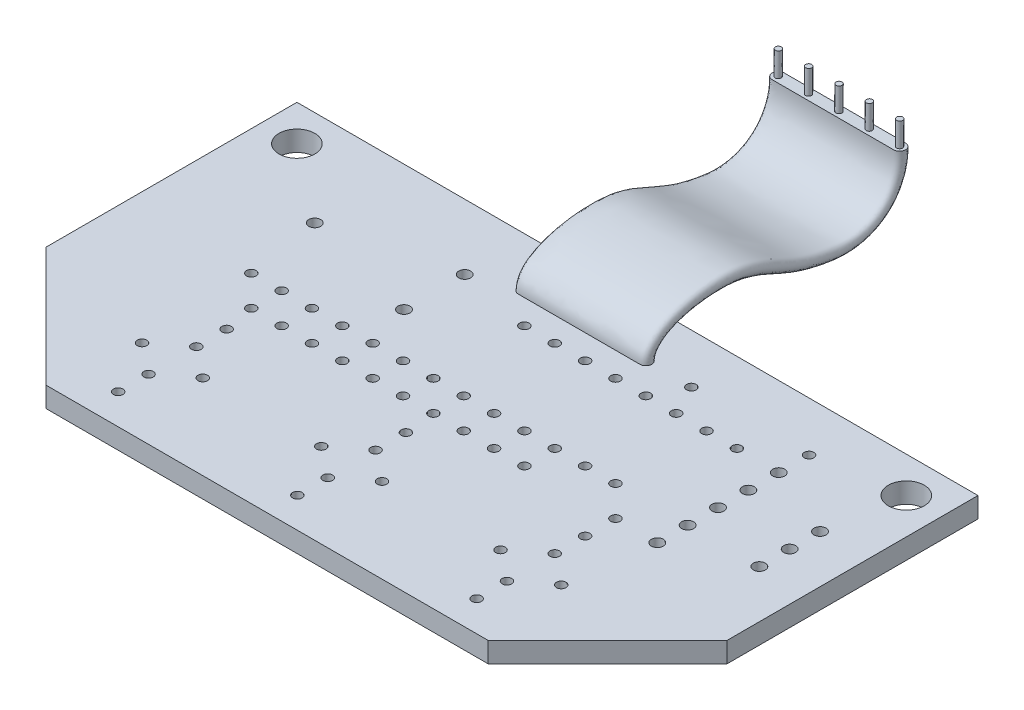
SolidWorks part; units mm, degrees
ref_plane "Plan de face" through (0, 0, 0) normal (0, 0, 1) x (1, 0, 0)
ref_plane "Plan de dessus" through (0, 0, 0) normal (0, 1, 0) x (1, 0, 0)
ref_plane "Plan de droite" through (0, 0, 0) normal (1, 0, 0) x (0, 0, -1)
sketch "Esquisse1" plane through (0, 0, 0) normal (0, 1, 0) x (1, 0, 0)
  line L0 (-55.0409, 0) -> (53.7356, 0) construction
  line L1 (0, -15.3375) -> (0, 42.5316) construction
  line L2 (-55.0409, 31) -> (53.7356, 31) construction
  line L3 (28.5, 49.7108) -> (28.5, -15.3375) construction
  line L4 (-28.5, -15.3375) -> (-28.5, 49.7108) construction
  line L5 (18.5, -8.4216) -> (18.5, 5.5761) construction
  line L6 (18.5, 0) -> (31.1747, 12.6747) construction
  line L7 (18.5, 0) -> (28.5, 10)
  line L8 (-18.5, 0) -> (-28.5, 10)
  line L9 (18.5, 0) -> (-18.5, 0)
  line L10 (-28.5, 10) -> (-28.5, 31)
  line L11 (-28.5, 31) -> (28.5, 31)
  line L12 (28.5, 31) -> (28.5, 10)
  line L13 (-4.1524, 2.54) -> (19.9169, 2.54) construction
  line L14 (-4.1524, 5.08) -> (14.1317, 5.08) construction
  line L15 (-4.1524, 9.08) -> (14.1317, 9.08) construction
  line L16 (-4.1524, 11.62) -> (14.1317, 11.62) construction
  line L17 (-4.7551, 7.08) -> (5.3471, 7.08) construction
  line L18 (-2.54, 9.6779) -> (-2.54, 6.3293) construction
  line L19 (2.54, 9.6779) -> (2.54, 6.3293) construction
  line L20 (31.1747, 28) -> (24.2659, 28) construction
  line L21 (25.5, 32.8728) -> (25.5, 26.441) construction
  line L22 (15, -3.0208) -> (15, 32.8728) construction
  line L23 (29.937, 14.16) -> (-30.6463, 14.16) construction
  line L24 (-35.9716, 23) -> (-4.1524, 23) construction
  line L25 (-9, 35.57) -> (-9, 18.2802) construction
  line L26 (-11.1435, 20.46) -> (-6.579, 20.46) construction
  line L27 (-11.1435, 25.54) -> (-6.579, 25.54) construction
  line L28 (-19.01, 27.5475) -> (-19.01, 20.2858) construction
  circle A0 centre (0, 2.54) radius 0.4
  circle A1 centre (0, 5.08) radius 0.4
  circle A2 centre (0, 9.08) radius 0.4
  circle A3 centre (0, 11.62) radius 0.4
  circle A4 centre (-2.54, 7.08) radius 0.4
  circle A5 centre (2.54, 7.08) radius 0.4
  circle A6 centre (15, 2.54) radius 0.4
  circle A7 centre (15, 5.08) radius 0.4
  circle A8 centre (17.54, 7.08) radius 0.4
  circle A9 centre (15, 9.08) radius 0.4
  circle A10 centre (12.46, 7.08) radius 0.4
  circle A11 centre (15, 11.62) radius 0.4
  circle A12 centre (-15, 11.62) radius 0.4
  circle A13 centre (-12.46, 7.08) radius 0.4
  circle A14 centre (-15, 9.08) radius 0.4
  circle A15 centre (-17.54, 7.08) radius 0.4
  circle A16 centre (-15, 5.08) radius 0.4
  circle A17 centre (-15, 2.54) radius 0.4
  circle A18 centre (25.5, 28) radius 1.5
  circle A19 centre (-25.5, 28) radius 1.5
  circle A20 centre (15, 14.16) radius 0.4
  circle A21 centre (18.5, 14.16) radius 0.5
  circle A22 centre (-5.32, 14.16) radius 0.4
  circle A23 centre (18.5, 16.7) radius 0.5
  circle A24 centre (-5.32, 16.7) radius 0.4
  circle A25 centre (18.5, 19.24) radius 0.5
  circle A26 centre (-7.86, 14.16) radius 0.4
  circle A27 centre (18.5, 21.78) radius 0.5
  circle A28 centre (15, 24.32) radius 0.4
  circle A29 centre (18.5, 24.32) radius 0.5
  circle A30 centre (24.5, 16.7) radius 0.5
  circle A31 centre (24.5, 19.24) radius 0.5
  circle A32 centre (24.5, 21.78) radius 0.5
  circle A33 centre (-7.86, 16.7) radius 0.4
  circle A34 centre (12.46, 16.7) radius 0.4
  circle A35 centre (-10.4, 14.16) radius 0.4
  circle A36 centre (-10.4, 16.7) radius 0.4
  circle A37 centre (12.46, 24.32) radius 0.4
  circle A38 centre (-12.94, 14.16) radius 0.4
  circle A39 centre (9.92, 16.7) radius 0.4
  circle A40 centre (-12.94, 16.7) radius 0.4
  circle A41 centre (-15.48, 14.16) radius 0.4
  circle A42 centre (9.92, 24.32) radius 0.4
  circle A43 centre (7.38, 14.16) radius 0.4
  circle A44 centre (7.38, 16.7) radius 0.4
  circle A45 centre (-15.48, 16.7) radius 0.4
  circle A46 centre (-9, 20.46) radius 0.5
  circle A47 centre (7.38, 24.32) radius 0.4
  circle A48 centre (4.84, 14.16) radius 0.4
  circle A49 centre (4.84, 16.7) radius 0.4
  circle A50 centre (-18.02, 16.7) radius 0.4
  circle A51 centre (-9, 25.54) radius 0.5
  circle A52 centre (4.84, 24.32) radius 0.4
  circle A53 centre (2.3, 14.16) radius 0.4
  circle A54 centre (2.3, 16.7) radius 0.4
  circle A55 centre (-19.01, 23) radius 0.5
  circle A56 centre (18.5, 26.86) radius 0.4
  circle A57 centre (2.3, 24.32) radius 0.4
  circle A58 centre (-0.24, 14.16) radius 0.4
  circle A59 centre (-0.24, 16.7) radius 0.4
  circle A62 centre (-0.24, 24.32) radius 0.4
  circle A63 centre (-2.78, 14.16) radius 0.4
  circle A64 centre (-2.78, 16.7) radius 0.4
  circle A67 centre (-2.78, 24.32) radius 0.4
  circle A68 centre (15, 16.7) radius 0.4
  circle A69 centre (15, 16.7) radius 0.4
  circle A70 centre (15, 19.24) radius 0.4
  circle A71 centre (15, 19.24) radius 0.4
  circle A72 centre (15, 21.78) radius 0.4
  circle A73 centre (15, 21.78) radius 0.4
  circle A74 centre (12.46, 19.24) radius 0.4
  circle A75 centre (12.46, 21.78) radius 0.4
  circle A76 centre (9.92, 19.24) radius 0.4
  circle A77 centre (9.92, 21.78) radius 0.4
  circle A78 centre (7.38, 19.24) radius 0.4
  circle A79 centre (7.38, 21.78) radius 0.4
  circle A80 centre (4.84, 19.24) radius 0.4
  circle A81 centre (4.84, 21.78) radius 0.4
  circle A82 centre (2.3, 19.24) radius 0.4
  circle A83 centre (2.3, 21.78) radius 0.4
  circle A84 centre (-0.24, 19.24) radius 0.4
  circle A85 centre (-0.24, 21.78) radius 0.4
  circle A86 centre (-2.78, 19.24) radius 0.4
  circle A87 centre (-2.78, 21.78) radius 0.4
  circle A88 centre (12.46, 14.16) radius 0.4
  circle A89 centre (9.92, 14.16) radius 0.4
  circle A90 centre (-18.02, 14.16) radius 0.4
  circle A93 centre (8.65, 26.86) radius 0.4
  dimension "D7" = 2.54
  dimension "D11" = 2.54
  dimension "D13" = 3
  dimension "D15" = 2.54
  dimension "D16" = 19.5
  dimension "D1" = 28.5
  dimension "D2" = 57
  dimension "D3" = 31
  dimension "D4" = 10
  dimension "D5" = 45
  dimension "D6" = 2.54
  dimension "D8" = 2
  dimension "D9" = 2
  dimension "D10" = 2.54
  dimension "D12" = 5.08
  dimension "D14" = 3
  dimension "D17" = 8
  dimension "D18" = 2.54
  dimension "D19" = 5.08
  dimension "D20" = 10.01
extrude "Extrusion1" add sketch "Esquisse1" along normal blind 1.7
sketch "Esquisse2" plane through (0, 1.7, 0) normal (0, 1, 0) x (-1, 0, 0)
  line L0 (-7.837, -26.86) -> (7.688, -26.86) construction
  line L1 (-4.84, -23.2473) -> (-4.84, -28.4927) construction
  line L2 (5.32, -25.1131) -> (5.32, -28.4927) construction
  line L3 (5.32, -27.36) -> (-4.84, -27.36)
  line L4 (5.32, -26.36) -> (-4.84, -26.36)
  arc A0 (-4.84, -26.36) -> (-4.84, -27.36) centre (-4.84, -26.86) ccw
  arc A1 (5.32, -27.36) -> (5.32, -26.36) centre (5.32, -26.86) ccw
ref_plane "Plan1" through (0, 0, 0) normal (1, 0, 0) x (0, 0, -1)
sketch "Esquisse3" plane through (0, 0, 0) normal (1, 0, 0) x (0, 0, -1)
  line L0 (26.86, 1.7) -> (15.345, 1.7) construction
  line L1 (26.86, 4.2992) -> (26.86, 0.7269) construction
  spline S0 degree 3 poles (26.86, 1.7) (26.8154, 4.0311) (31.9395, 4.9073) (37.3409, 3.7192) (38.3746, 2.4176) (45.8803, 1.3555) (48.1301, 3.6782) (48.0954, 6.6268) knots 0 0 0 0 0.348479 0.348479 0.680817 0.680817 1 1 1 1
sweep "Balayage1" add profiles "Esquisse2" path "Esquisse3"
sketch "Esquisse4" plane through (0, 6.9814, -0.0515) normal (0, 1, -0.0074) x (-1, 0, 0)
  line L0 (-5.9768, -48.0452) -> (6.2124, -48.0452) construction
  line L1 (-4.84, -49.9884) -> (-4.84, -47.1971) construction
  circle A0 centre (-4.84, -48.0452) radius 0.25
  circle A1 centre (-2.3, -48.0452) radius 0.25
  circle A2 centre (0.24, -48.0452) radius 0.25
  circle A3 centre (2.78, -48.0452) radius 0.25
  circle A4 centre (5.32, -48.0452) radius 0.25
extrude "Extrusion2" add sketch "Esquisse4" along normal blind 2
